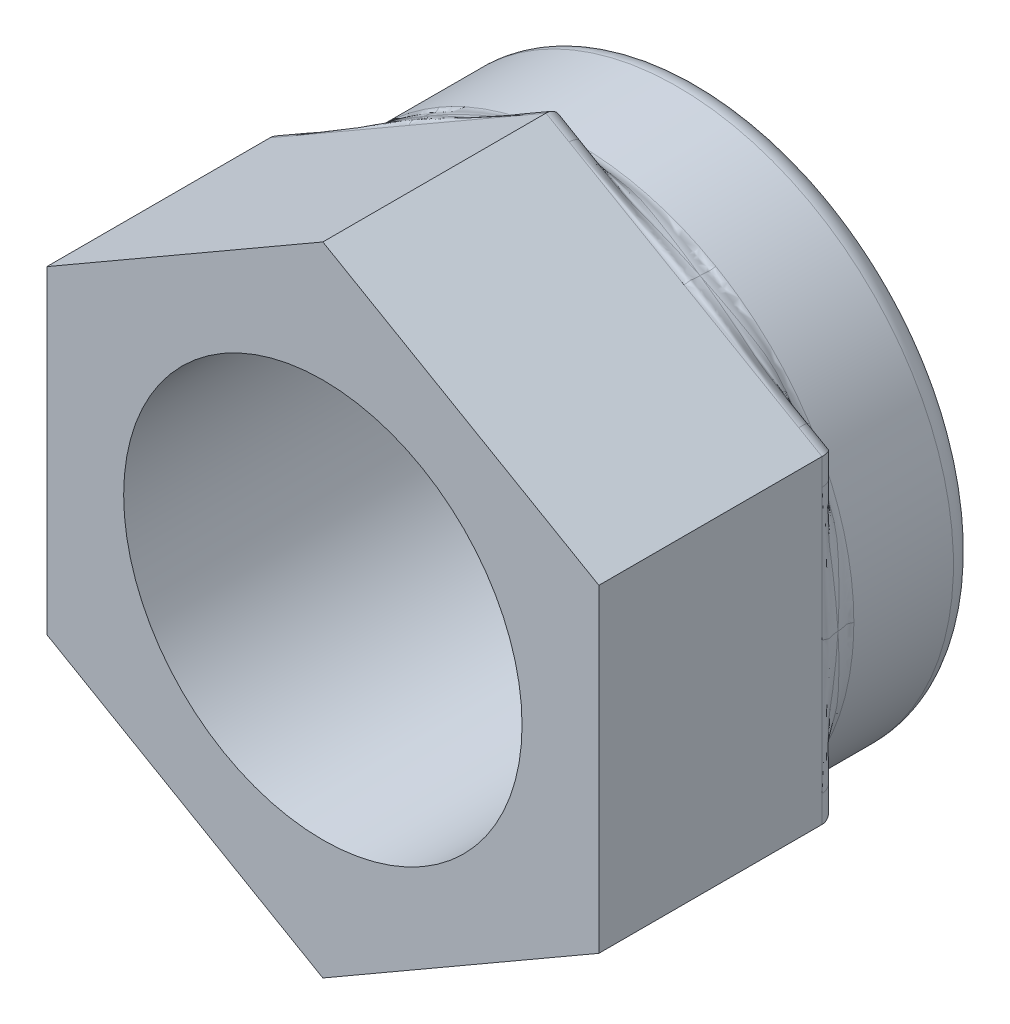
SolidWorks part; units mm, degrees
ref_plane "Face" through (0, 0, 0) normal (0, 0, 1) x (1, 0, 0)
ref_plane "Dessus" through (0, 0, 0) normal (0, 1, 0) x (1, 0, 0)
ref_plane "Droite" through (0, 0, 0) normal (1, 0, 0) x (0, 0, -1)
sketch "Esquisse1" plane through (0, 0, 0) normal (0, 0, 1) x (1, 0, 0)
  line L1 (0, -4) -> (3.4641, -2)
  line L2 (3.4641, -2) -> (3.4641, 2)
  line L3 (3.4641, 2) -> (0, 4)
  line L4 (0, 4) -> (-3.4641, 2)
  line L5 (-3.4641, 2) -> (-3.4641, -2)
  line L6 (-3.4641, -2) -> (0, -4)
  circle A0 centre (0, 0) radius 3.4641 construction
  dimension "D1" = 4
extrude "Extrusion1" add sketch "Esquisse1" against normal blind 3
sketch "Esquisse2" plane through (0, 0, -3) normal (0, 0, -1) x (-1, 0, 0)
  line L0 (-3.4641, -2) -> (-3.4641, 2) construction
  circle A0 centre (0, 0) radius 3.4641
extrude "Extrusion2" add sketch "Esquisse2" along normal blind 1.75
fillet "Congé1" radius 0.2
fillet "Congé2" radius 0.3
sketch "Esquisse3" plane through (0, 0, 0) normal (0, 0, 1) x (1, 0, 0)
  circle A0 centre (0, 0) radius 2.5
  dimension "D1" = 5
extrude "Enlèv. mat.-Extru.1" cut sketch "Esquisse3" against normal blind 11.75
